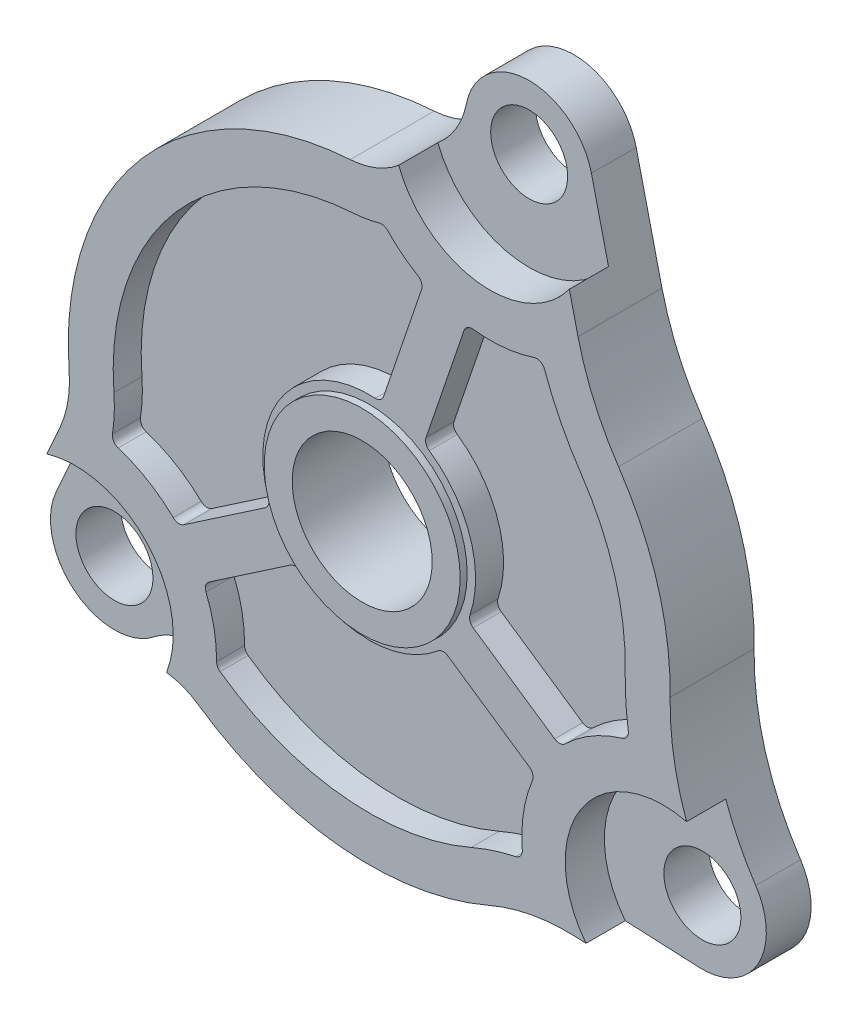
SolidWorks part; units mm, degrees
ref_plane "Plane1" through (0, 0, 0) normal (0, 0, 1) x (1, 0, 0)
ref_plane "Plane2" through (0, 0, 0) normal (0, 1, 0) x (-1, 0, 0)
ref_plane "Plane3" through (0, 0, 0) normal (1, 0, 0) x (0, 0, -1)
sketch "Sketch1" plane through (0, 0, 0) normal (0, 0, 1) x (1, 0, 0)
  line L0 (-26.67, -18.1463) -> (26.67, -18.1463) construction
  line L1 (0, 0) -> (-26.67, -18.1463) construction
  line L2 (0, 0) -> (26.67, -18.1463) construction
  line L3 (10.9563, 32.2244) -> (0, 0) construction
  line L4 (16.6043, 33.5606) -> (18.9435, 23.6736)
  line L6 (18.789, -23.5906) -> (26.4008, -23.944)
  line L11 (-28.0689, -6.9945) -> (-31.9746, -15.7912)
  line L12 (-18.0518, -25.6544) -> (0, 0) construction
  arc A0 (-15.5264, -22.4609) -> (-23.0728, -22.7011) centre (-19.1372, -27.6844) ccw
  arc A1 (-31.9746, -15.7912) -> (-23.0728, -22.7011) centre (-26.67, -18.1463) ccw
  arc A3 (16.6043, 33.5606) -> (5.2649, 33.3618) centre (10.9563, 32.2244) ccw
  arc A4 (27.3007, -0.4835) -> (22.6196, 15.2943) centre (0, 0) ccw
  arc A5 (31.511, -14.9447) -> (27.3007, -0.4835) centre (52.6967, -0.9332) cw
  arc A6 (5.2649, 33.3618) -> (-1.7257, 27.2504) centre (-2.2073, 34.8552) cw
  arc A7 (-1.7257, 27.2504) -> (-27.2247, -2.0929) centre (0, 0) ccw
  arc A9 (26.4008, -23.944) -> (31.511, -14.9447) centre (26.67, -18.1463) ccw
  arc A10 (-15.5264, -22.4609) -> (10.8798, -25.0438) centre (0, 0) ccw
  arc A12 (-27.2247, -2.0929) -> (-28.0689, -6.9945) centre (-37.3548, -2.8716) cw
  arc A13 (22.6196, 15.2943) -> (18.9435, 23.6736) centre (43.6611, 29.5216) cw
  arc A14 (18.789, -23.5906) -> (10.8798, -25.0438) centre (17.9643, -41.3514) ccw
  circle A18 centre (10.9563, 32.2244) radius 3.4925
  circle A19 centre (-26.67, -18.1463) radius 3.4925
  circle A20 centre (26.67, -18.1463) radius 3.4925
  dimension "D1" = 54.61
  dimension "D2" = 53.34
  dimension "D3" = 11.6078
  dimension "D4" = 32.258
  dimension "D7" = 6.35
  dimension "D8" = 10.16
  dimension "D9" = 7.62
  dimension "D10" = 25.4
  dimension "D11" = 17.78
  dimension "D20" = 6.985
  dimension "D5" = 34.036
  dimension "D6" = 105.453
  dimension "D12" = 10.16
  dimension "D13" = 7.62
  dimension "D17" = 31.369
  dimension "D18" = 11.43
  dimension "D19" = 9.6247
extrude "Base" add sketch "Sketch1" along normal blind 7.62
ref_plane "Plane5" through (0, 0, 8.255) normal (0, 0, 1) x (1, 0, 0)
sketch "Sketch2" plane through (0, 0, 8.255) normal (0, 0, 1) x (1, 0, 0)
  circle A0 centre (0, 0) radius 8.89
  dimension "D1" = 17.78
extrude "Boss-Extrude1" add sketch "Sketch2" against normal up to surface (0.635 mm away)
sketch "Sketch3" plane through (0, 0, 7.62) normal (0, 0, 1) x (1, 0, 0)
  line L0 (-16.8205, -8.987) -> (-9.4374, -3.9635)
  line L1 (8.6002, 18.9822) -> (5.1532, 8.8441)
  line L2 (4.7525, 20.2904) -> (1.3055, 10.1523)
  line L3 (7.1513, -7.3235) -> (14.5343, -12.347)
  line L4 (-14.5343, -12.347) -> (-7.1513, -7.3235)
  line L5 (9.4374, -3.9635) -> (16.8205, -8.987)
  arc A0 (-1.4681, 23.1825) -> (-23.1606, -1.7805) centre (0, 0) ccw
  arc A1 (-9.4374, -3.9635) -> (-9.1442, -3.0896) centre (-9.8661, -3.3335) ccw
  arc A2 (9.1442, -3.0896) -> (5.4448, 7.9696) centre (0, 0) ccw
  arc A3 (5.1532, 8.8441) -> (5.4448, 7.9696) centre (5.8747, 8.5988) ccw
  arc A4 (0.5414, 9.6368) -> (1.3055, 10.1523) centre (0.5841, 10.3976) ccw
  arc A5 (-13.5281, -18.8831) -> (9.2557, -21.3053) centre (0, 0) ccw
  arc A6 (13.2921, -20.0006) -> (9.2557, -21.3053) centre (17.9643, -41.3514) ccw
  arc A7 (13.2921, -20.0006) -> (13.8887, -19.1939) centre (13.1292, -19.2562) ccw
  arc A8 (14.8104, -13.2669) -> (13.8887, -19.1939) centre (26.67, -18.1463) ccw
  arc A9 (14.8104, -13.2669) -> (14.5343, -12.347) centre (14.1057, -12.977) ccw
  arc A10 (7.1513, -7.3235) -> (6.2307, -7.3715) centre (6.7226, -7.9535) ccw
  arc A11 (-6.2307, -7.3715) -> (-7.1513, -7.3235) centre (-6.7226, -7.9535) ccw
  arc A12 (-13.8463, -18.2571) -> (-14.8104, -13.2669) centre (-26.67, -18.1463) ccw
  arc A13 (-14.5343, -12.347) -> (-14.8104, -13.2669) centre (-14.1057, -12.977) ccw
  arc A14 (-13.8463, -18.2571) -> (-13.5281, -18.8831) centre (-13.0843, -18.2637) ccw
  arc A15 (-17.7775, -8.906) -> (-16.8205, -8.987) centre (-17.2492, -8.357) ccw
  arc A16 (-17.7775, -8.906) -> (-22.7707, -5.9293) centre (-26.67, -18.1463) ccw
  arc A17 (22.972, -5.8669) -> (17.7775, -8.906) centre (26.67, -18.1463) ccw
  arc A18 (22.972, -5.8669) -> (23.5069, -5.0313) centre (22.7523, -5.1373) ccw
  arc A19 (23.2253, -0.4113) -> (23.5069, -5.0313) centre (52.6967, -0.9332) ccw
  arc A20 (23.2253, -0.4113) -> (19.2429, 13.0112) centre (0, 0) ccw
  arc A21 (15.9142, 19.5741) -> (19.2429, 13.0112) centre (43.6611, 29.5216) ccw
  arc A22 (9.4133, 19.4933) -> (8.6002, 18.9822) centre (9.3216, 18.7369) ccw
  arc A23 (9.4133, 19.4933) -> (14.9591, 20.0409) centre (10.9563, 32.2244) ccw
  arc A24 (16.8205, -8.987) -> (17.7775, -8.906) centre (17.2492, -8.357) ccw
  arc A25 (9.1442, -3.0896) -> (9.4374, -3.9635) centre (9.8661, -3.3335) ccw
  arc A26 (15.9142, 19.5741) -> (14.9591, 20.0409) centre (15.1969, 19.317) ccw
  arc A27 (-1.4681, 23.1825) -> (0.9185, 23.5845) centre (-2.2073, 34.8552) ccw
  arc A28 (4.7525, 20.2904) -> (4.4195, 21.1912) centre (4.0311, 20.5357) ccw
  arc A29 (1.6737, 23.376) -> (4.4195, 21.1912) centre (10.9563, 32.2244) ccw
  arc A30 (1.6737, 23.376) -> (0.9185, 23.5845) centre (1.1222, 22.8502) ccw
  arc A31 (-23.2918, -5.0849) -> (-23.1606, -1.7805) centre (-37.3548, -2.8716) ccw
  arc A32 (-23.2918, -5.0849) -> (-22.7707, -5.9293) centre (-22.5391, -5.2034) ccw
  arc A33 (-6.2307, -7.3715) -> (6.2307, -7.3715) centre (0, 0) ccw
  arc A34 (0.5414, 9.6368) -> (-9.1442, -3.0896) centre (0, 0) ccw
extrude "Ribs" cut sketch "Sketch3" against normal blind 2.54
sketch "Sketch4" plane through (0, 0, 7.62) normal (0, 0, 1) x (1, 0, 0)
  line L0 (18.1547, 27.0075) -> (18.1547, 40.0401)
  line L1 (2.6711, 29.0015) -> (2.6711, 40.0401)
  line L2 (2.6711, 40.0401) -> (18.1547, 40.0401)
  arc A3 (2.6711, 29.0015) -> (18.1547, 27.0075) centre (10.9563, 32.2244) ccw
extrude "Ear 1" cut sketch "Sketch4" against normal blind 3.556
sketch "Sketch5" plane through (0, 0, 7.62) normal (0, 0, 1) x (1, 0, 0)
  line L0 (37.5407, -9.5127) -> (37.5407, -27.8508)
  line L1 (37.5407, -27.8508) -> (19.674, -27.8508)
  line L2 (37.5407, -9.5127) -> (28.7896, -9.5127)
  line L3 (19.674, -23.6317) -> (19.674, -27.8508)
  arc A0 (28.7896, -9.5127) -> (19.674, -23.6317) centre (26.67, -18.1463) ccw
extrude "Ear 2" cut sketch "Sketch5" against normal blind 3.556
sketch "Sketch6" plane through (0, 0, 7.62) normal (0, 0, 1) x (1, 0, 0)
  line L0 (-29.2419, -9.6365) -> (-37.3548, -9.6365)
  line L1 (-20.6172, -25.6556) -> (-20.6172, -30.1962)
  line L2 (-20.6172, -30.1962) -> (-37.3548, -30.1962)
  line L3 (-37.3548, -30.1962) -> (-37.3548, -9.6365)
  arc A0 (-20.001, -24.0249) -> (-29.2419, -9.6365) centre (-26.67, -18.1463) ccw
  arc A1 (-20.001, -24.0249) -> (-20.6172, -25.6556) centre (-18.1511, -25.6556) ccw
extrude "Ear 3" cut sketch "Sketch6" against normal blind 3.556
sketch "Sketch7" plane through (0, 0, 8.255) normal (0, 0, 1) x (1, 0, 0)
  circle A0 centre (0, 0) radius 6.35
  dimension "D1" = 12.7
extrude "Cut-Extrude5" cut sketch "Sketch7" against normal through all
ref_plane "Plane6" through (0, 0, -2.54) normal (0, 0, -1) x (-1, 0, 0)
sketch "Stock" plane through (0, 0, -2.54) normal (0, 0, -1) x (-1, 0, 0)
  line L1 (34.925, -29.5633) -> (-34.925, -29.5633)
  line L2 (34.925, -29.5633) -> (34.925, 40.2867)
  line L3 (34.925, 40.2867) -> (-34.925, 40.2867)
  line L4 (-34.925, -29.5633) -> (-34.925, 40.2867)
  dimension "D1" = 69.85
  dimension "D2" = 69.85
